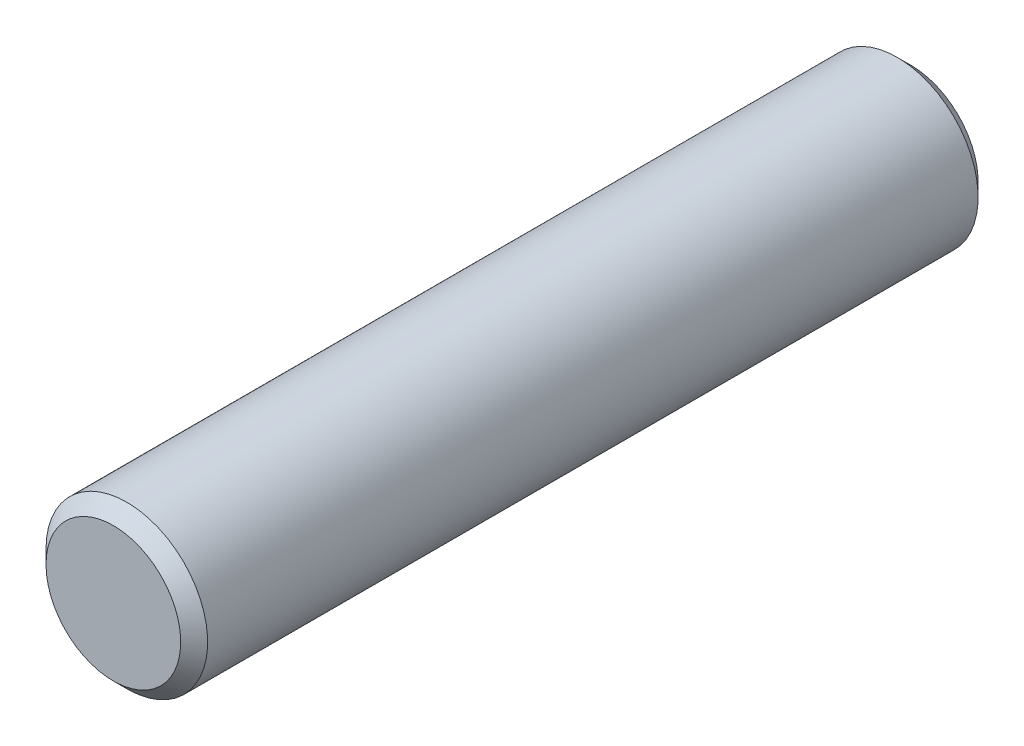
SolidWorks part; units mm, degrees
ref_plane "XZ (Face)" through (0, 0, 0) normal (0, 0, 1) x (1, 0, 0)
ref_plane "XY (Dessus)" through (0, 0, 0) normal (0, 1, 0) x (1, 0, 0)
ref_plane "YZ (Droite)" through (0, 0, 0) normal (1, 0, 0) x (0, 0, -1)
sketch "Esquisse1" plane through (0, 0, 0) normal (0, 0, 1) x (1, 0, 0)
  circle A0 centre (0, 0) radius 1.5 construction
  circle A1 centre (0, 0) radius 1.5
extrude "Base-Extrusion" add sketch "Esquisse1" along normal up to surface and the other way up to surface
chamfer "Chanfrein1" distance 0.25 angle 45
